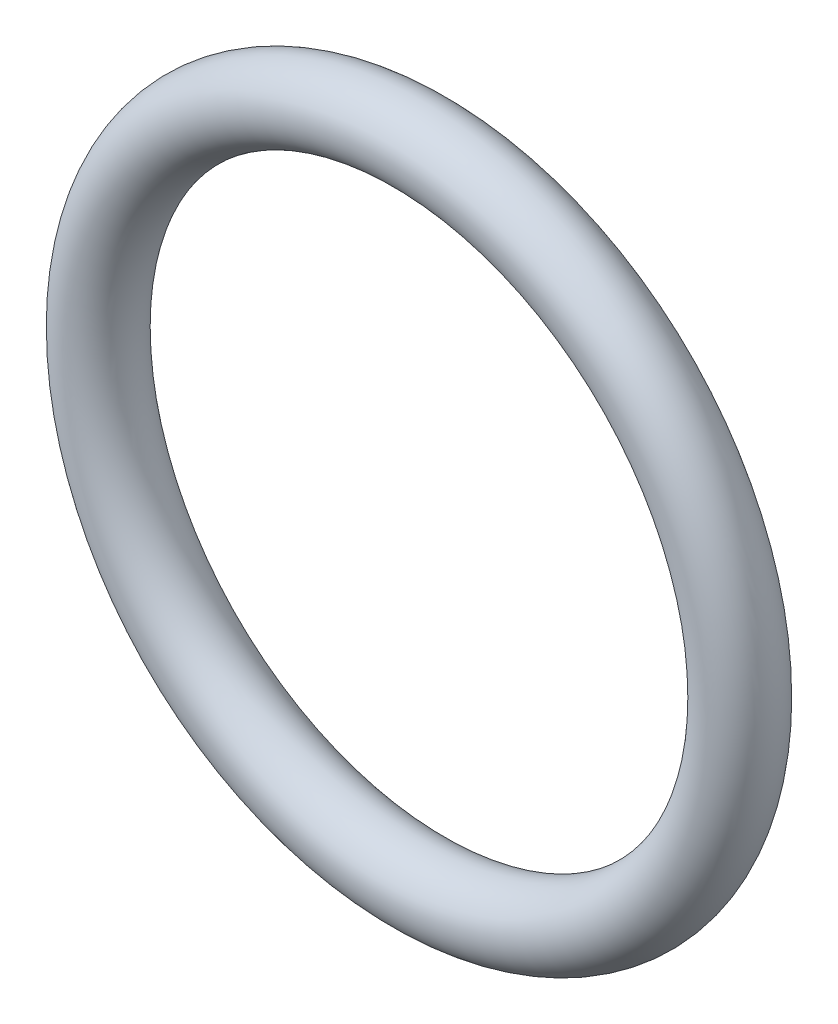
SolidWorks part; units mm, degrees
ref_plane "Plan de face" through (0, 0, 0) normal (0, 0, 1) x (1, 0, 0)
ref_plane "Plan de dessus" through (0, 0, 0) normal (0, 1, 0) x (1, 0, 0)
ref_plane "Plan de droite" through (0, 0, 0) normal (1, 0, 0) x (0, 0, -1)
sketch "Esquisse1" plane through (0, 0, 0) normal (1, 0, 0) x (0, 0, -1)
  line L0 (-36.4198, 0) -> (11.2752, 0) construction
  line L1 (0, -12.273) -> (0, 55.378) construction
  line L2 (-36.4198, 22.7) -> (11.2752, 22.7) construction
  circle A0 centre (0, 22.7) radius 2.6
  dimension "D1" = 22.7
revolve "Révolution1" add sketch "Esquisse1" angle 360 about L0
